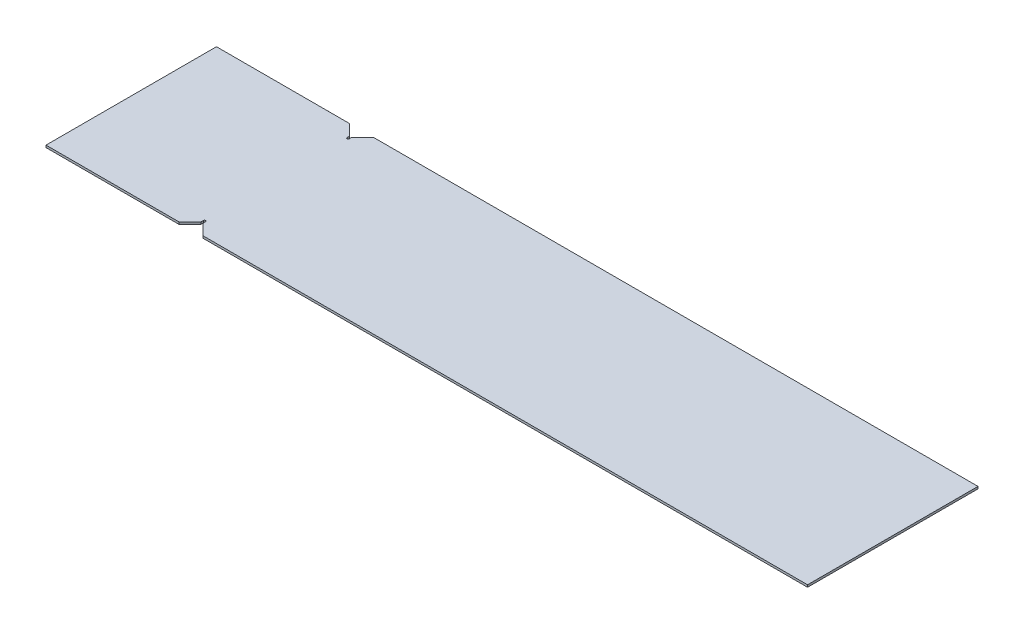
SolidWorks part; units mm, degrees
ref_plane "Ebene vorne" through (0, 0, 0) normal (0, 0, 1) x (1, 0, 0)
ref_plane "Ebene oben" through (0, 0, 0) normal (0, 1, 0) x (1, 0, 0)
ref_plane "Ebene rechts" through (0, 0, 0) normal (1, 0, 0) x (0, 0, -1)
sketch "Sketch1" plane through (0, 0, 0) normal (0, 1, 0) x (1, 0, 0)
  line L2 (0, 0) -> (0, 235)
  line L4 (1050, 0) -> (1050, 235)
  line L5 (216.5, 235) -> (201.5, 220)
  line L6 (1050, 117.5) -> (0, 117.5) construction
  line L8 (183.5, 235) -> (0, 235)
  line L9 (216.5, 235) -> (1050, 235)
  line L10 (201.5, 220) -> (201.5, 216.5)
  line L11 (200, 215) -> (200, 231.4307) construction
  line L12 (198.5, 220) -> (198.5, 216.5)
  line L13 (183.5, 235) -> (198.5, 220)
  line L14 (200, 215) -> (104.2324, 215) construction
  line L15 (216.5, 0) -> (1050, 0)
  line L16 (183.5, 0) -> (0, 0)
  line L17 (216.5, 0) -> (201.5, 15)
  line L18 (201.5, 15) -> (201.5, 18.5)
  line L19 (198.5, 15) -> (198.5, 18.5)
  line L20 (183.5, 0) -> (198.5, 15)
  arc A0 (201.5, 216.5) -> (198.5, 216.5) centre (200, 216.5) cw
  arc A1 (201.5, 18.5) -> (198.5, 18.5) centre (200, 18.5) ccw
  dimension "D3" = 45
  dimension "D1" = 235
  dimension "D2" = 1050
  dimension "D4" = 1.5
  dimension "D5" = 20
  dimension "D6" = 15
  dimension "D7" = 200
base flange "Base-Flange1" sketch "Sketch1" thickness 3 reverse thickness direction no parameters "D1"=1.5
sketch "Biegungen" plane through (0, 0, 0) normal (0, 1, 0) x (1, 0, 0)
  line L4 (200, 215) -> (200, 20)
  line L5 (198.5, 218.25) -> (0, 218.25)
  line L11 (198.5, 216.5) -> (198.5, 220) construction
  line L12 (0, 235) -> (0, 0) construction
  line L13 (201.5, 218.25) -> (1050, 218.25)
  line L14 (201.5, 220) -> (201.5, 216.5) construction
  line L15 (1050, 0) -> (1050, 235) construction
  arc A0 (198.5, 216.5) -> (201.5, 216.5) centre (200, 216.5) ccw construction
  arc A1 (201.5, 18.5) -> (198.5, 18.5) centre (200, 18.5) ccw construction
sketch "Bend-Lines1" plane through (0, 0, 0) normal (0, 1, 0) x (1, 0, 0)
sketch "Bounding-Box1" plane through (0, 0, 0) normal (0, 1, 0) x (1, 0, 0)
sheet metal parameters "Sheet-Metal5" thickness 3 parameters "D1"=1.5
flat pattern "Flat-Pattern5"
sketch "Bend-Lines2" plane through (0, 0, 0) normal (0, 1, 0) x (1, 0, 0)
sketch3d "Bounding-Box2"
  line L0 (850, 18.5, 0) -> (-200, 18.5, 0) construction
  line L1 (850, -216.5, 0) -> (-200, -216.5, 0) construction
  line L2 (850, 18.5, 0) -> (850, -216.5, 0) construction
  line L3 (-200, 18.5, 0) -> (-200, -216.5, 0) construction
